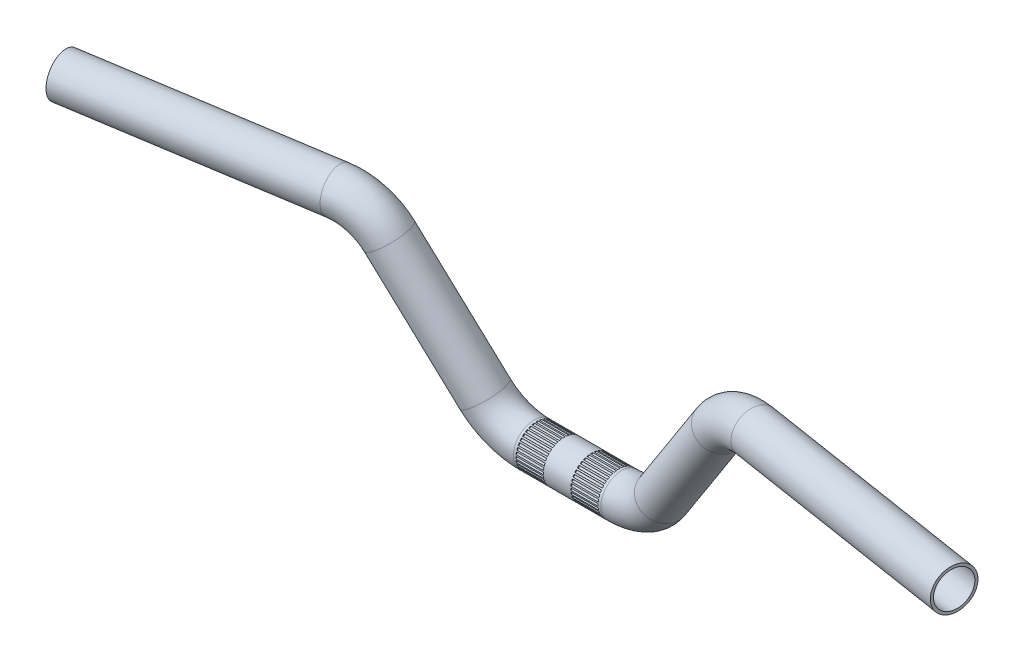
SolidWorks part; units mm, degrees
ref_plane "Front Plane" through (0, 0, 0) normal (0, 0, 1) x (1, 0, 0)
ref_plane "Top Plane" through (0, 0, 0) normal (0, 1, 0) x (1, 0, 0)
ref_plane "Right Plane" through (0, 0, 0) normal (1, 0, 0) x (0, 0, -1)
ref_plane "Plane1" through (0, 0, 25) normal (0, 0, 1) x (1, 0, 0)
ref_plane "Plane2" through (0, 0, 63) normal (0, 0, 1) x (1, 0, 0)
sketch "Sketch1" plane through (0, 0, 25) normal (0, 0, 1) x (1, 0, 0)
  point P0 (165, 140)
  dimension "D1" = 165
  dimension "D2" = 140
sketch "Sketch2" plane through (0, 0, 63) normal (0, 0, 1) x (1, 0, 0)
  point P0 (406, 140)
  dimension "D1" = 406
  dimension "D2" = 140
sketch3d "3DSketch1"
  line L0 (0, 0, 0) -> (39.8845, 0, 0)
  line L1 (80.9205, 21.0998, 3.7678) -> (150.4234, 119.3866, 21.319)
  line L2 (190.2022, 140, 28.9738) -> (406, 140, 63)
  arc A0 (190.2022, 140, 28.9738) -> (150.4234, 119.3866, 21.319) centre (190.717, 90.1094, 25.7087) ccw
  arc A1 (80.9205, 21.0998, 3.7678) -> (39.8845, 0, 0) centre (39.8845, 49.2214, 8.7895) ccw
  point P9 (165, 140, 25)
  point P10 (182.9464, 86.804, 74.9905)
  point P13 (66, 0, 0)
  point P14 (39.8845, 58.0109, -40.4318)
  dimension "D2" = 50
  dimension "D1" = 66
sketch "Sketch4" plane through (0, 0, 0) normal (1, 0, 0) x (0, 0, -1)
  circle A0 centre (0, 0) radius 19
  dimension "D1" = 38
sweep "Sweep-Thin1" add profiles "Sketch4" path "3DSketch1" parameters "D1"=2.5
mirror "Mirror1" about plane through (0, 0, 0) normal (1, 0, 0) of "Sweep-Thin1"
sketch "Sketch11" plane through (0, 0, 0) normal (1, 0, 0) x (0, 0, -1)
  line L0 (0, 97.9) -> (0, -97.9) construction
  circle A0 centre (0, -19) radius 1
  dimension "D1" = 2
  dimension "D2" = 19
extrude "Cut-Extrude1" cut sketch "Sketch11" along normal blind 25 from offset 12.5
pattern_circular "CirPattern1" count 36 over 360 about axis through (0, 0, 0) along (1, 0, 0) of "Cut-Extrude1"
mirror "Mirror2" about plane through (0, 0, 0) normal (1, 0, 0) of "CirPattern1", "Cut-Extrude1"
